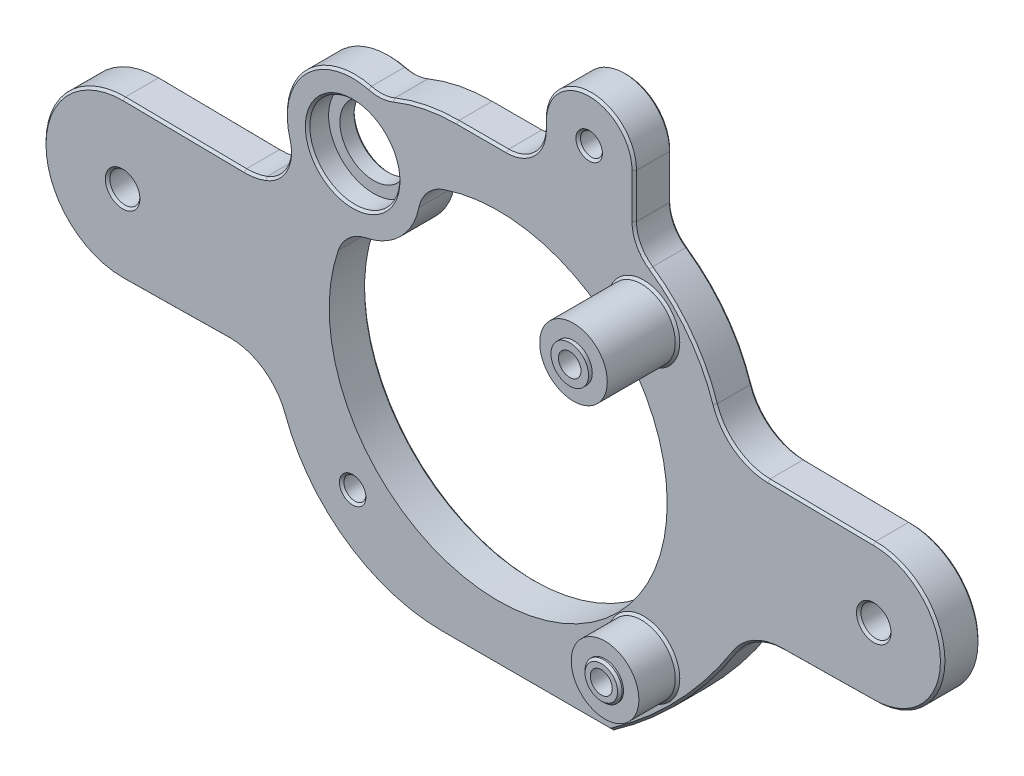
SolidWorks part; units mm, degrees
ref_plane "Plan de face" through (0, 0, 0) normal (0, 0, 1) x (1, 0, 0)
ref_plane "Plan de dessus" through (0, 0, 0) normal (0, 1, 0) x (1, 0, 0)
ref_plane "Plan de droite" through (0, 0, 0) normal (1, 0, 0) x (0, 0, -1)
sketch "Esquisse1" plane through (0, 0, 0) normal (0, 0, 1) x (1, 0, 0)
  line L0 (0, 0) -> (-38.75, 38.75) construction
  line L1 (0, 0) -> (35.404, 0) construction
  line L2 (24.2287, 72.0714) -> (24.2287, 52.2731) construction
  line L3 (-67.5838, 20.5722) -> (-99.8269, 20.9993)
  line L4 (-15, -60) -> (30.1201, -60)
  line L6 (2.2287, 60) -> (-11.0217, 60)
  line L7 (60, -60) -> (-60, 60) construction
  line L8 (60, 60) -> (-60, -60) construction
  line L9 (36.2287, 72.0714) -> (36.2287, 60.2744)
  line L10 (12.2287, 72.0714) -> (12.2287, 70)
  line L11 (100, 0) -> (-100, 0) construction
  line L12 (99.8094, -18.3536) -> (75.4463, -18.6759)
  line L13 (99.8786, 18.3542) -> (71.8047, 18.726)
  line L14 (0, 0) -> (0, -27.8905) construction
  line L15 (-71.5442, -20.6205) -> (-100.1731, -20.9993)
  line L16 (-60, 15) -> (-60, 0)
  line L17 (60, -30.1201) -> (60, -21)
  circle A0 centre (-38.75, 38.75) radius 2.925 construction
  circle A1 centre (38.75, 38.75) radius 2.925 construction
  circle A2 centre (38.75, -38.75) radius 2.925
  circle A3 centre (-38.75, -38.75) radius 2.925
  circle A4 centre (0, 0) radius 60 construction
  arc A5 (75.4463, -18.6759) -> (62.9711, -25.6508) centre (75.6447, -33.6746) ccw
  circle A6 centre (-38.75, -38.75) radius 1.5 construction
  arc A7 (57.7525, 29.0435) -> (40.5508, 52.0427) centre (15, 15) ccw
  arc A8 (-11.0217, 60) -> (-28.0842, 56.6398) centre (-11.0217, 15) ccw
  circle A9 centre (38.75, 38.75) radius 9 construction
  circle A10 centre (38.75, -38.75) radius 9 construction
  circle A11 centre (-38.75, -38.75) radius 9 construction
  circle A12 centre (-38.75, 38.75) radius 9
  arc A13 (-42.5804, 14.5572) -> (-14.5572, 42.5804) centre (0, 0) ccw
  arc A14 (30.1201, -60) -> (62.9711, -25.6508) centre (-38.75, 38.75) ccw
  circle A15 centre (38.75, 38.75) radius 2.925
  circle A16 centre (19.5, 56) radius 1.5 construction
  circle A17 centre (38.75, 38.75) radius 24.3481 construction
  circle A18 centre (-38.75, 38.75) radius 59.2505 construction
  circle A19 centre (24.2287, 72.0714) radius 12 construction
  circle A20 centre (24.2287, 72.0714) radius 2.925
  arc A21 (36.2287, 72.0714) -> (12.2287, 72.0714) centre (24.2287, 72.0714) ccw
  arc A22 (40.5508, 52.0427) -> (36.2287, 60.2744) centre (46.2287, 60.2744) cw
  arc A23 (12.2287, 70) -> (2.2287, 60) centre (2.2287, 70) cw
  arc A24 (99.8094, -18.3536) -> (99.8786, 18.3542) centre (100, 0) ccw
  arc A25 (-99.8269, 20.9993) -> (-100.1731, -20.9993) centre (-100, 0) ccw
  circle A26 centre (-100, 0) radius 4
  circle A27 centre (100, 0) radius 4
  arc A28 (-57.2593, -30.4644) -> (-15, -60) centre (-15, -15) ccw
  arc A29 (-71.5442, -20.6205) -> (-57.2593, -30.4644) centre (-71.3458, -35.6192) cw
  arc A30 (71.8047, 18.726) -> (57.7525, 29.0435) centre (72.0034, 33.7247) cw
  arc A31 (-62.1032, 21.5317) -> (-67.5838, 20.5722) centre (-67.3852, 35.5709) cw
  arc A32 (-34.3309, 56.1991) -> (-56.0265, 33.6979) centre (-38.75, 38.75) ccw
  arc A33 (-35.1295, 21.1179) -> (-21.1179, 35.1295) centre (-38.75, 38.75) ccw
  arc A34 (-14.5572, 42.5804) -> (-21.1179, 35.1295) centre (-11.3223, 33.1181) ccw
  arc A35 (-28.0842, 56.6398) -> (-34.3309, 56.1991) centre (-31.8759, 65.8931) cw
  arc A36 (-56.0265, 33.6979) -> (-62.1032, 21.5317) centre (-65.6245, 30.8912) cw
  arc A37 (-42.5804, 14.5572) -> (-35.1295, 21.1179) centre (-33.1181, 11.3223) cw
  point P14 (0, 0)
  point P23 (0, 0)
  point P39 (0, 0)
  point P46 (24.2287, 62.1723)
  point P57 (0, 0)
  point P75 (-59.6671, -20.4634)
  point P80 (-55.6948, 20.4148)
  point P92 (-39.9109, 20.7875)
  dimension "D1" = 45
  dimension "D2" = 4
  dimension "D4" = 5.85
  dimension "D7" = 18
  dimension "D3" = 120
  dimension "D5" = 77.5
  dimension "D6" = 15
  dimension "D8" = 4
  dimension "D9" = 90
  dimension "D10" = 5.85
  dimension "D11" = 45
  dimension "D12" = 3
  dimension "D13" = 3
  dimension "D14" = 4
  dimension "D15" = 19.5
  dimension "D16" = 24
  dimension "D17" = 5.85
  dimension "D18" = 10
  dimension "D20" = 21
  dimension "D21" = 8
  dimension "D22" = 36
  dimension "D23" = 10
  dimension "D24" = 10
  dimension "D19" = 200
extrude "Boss.-Extru.1" add sketch "Esquisse1" along normal blind 10
sketch "Esquisse3" plane through (0, 0, 10) normal (0, 0, 1) x (1, 0, 0)
  circle A0 centre (38.75, -38.75) radius 2.925
  circle A1 centre (38.75, -38.75) radius 9
  circle A2 centre (38.75, -38.75) radius 2.925 construction
  dimension "D1" = 18
extrude "Boss.-Extru.2" add sketch "Esquisse3" along normal blind 11.3
sketch "Esquisse7" plane through (0, 0, 21.3) normal (0, 0, 1) x (1, 0, 0)
  circle A0 centre (38.75, -38.75) radius 4.925
  circle A1 centre (38.75, -38.75) radius 9
  circle A2 centre (38.75, -38.75) radius 2.925 construction
  dimension "D1" = 2
extrude "Enlèv. mat.-Extru.3" cut sketch "Esquisse7" against normal blind 1
sketch "Esquisse4" plane through (0, 0, 10) normal (0, 0, 1) x (1, 0, 0)
  circle A0 centre (38.75, 38.75) radius 3
  circle A1 centre (38.75, 38.75) radius 9
  circle A2 centre (-100, 0) radius 4 construction
  circle A3 centre (-100, 0) radius 13.5 construction
  circle A4 centre (100, 0) radius 4 construction
  circle A5 centre (100, 0) radius 13.5 construction
  circle A6 centre (-100, 0) radius 4 construction
  dimension "D1" = 6
  dimension "D2" = 18
  dimension "D3" = 27
extrude "Boss.-Extru.3" add sketch "Esquisse4" along normal blind 19.7
sketch "Esquisse5" plane through (0, 0, 10) normal (0, 0, 1) x (1, 0, 0)
  circle A0 centre (-38.75, 38.75) radius 12
  dimension "D1" = 24
extrude "Enlèv. mat.-Extru.1" cut sketch "Esquisse5" against normal blind 5.6
sketch "Esquisse6" plane through (0, 0, 29.7) normal (0, 0, 1) x (1, 0, 0)
  circle A0 centre (38.75, 38.75) radius 5
  circle A1 centre (38.75, 38.75) radius 9
  circle A2 centre (38.75, 38.75) radius 3 construction
  dimension "D1" = 2
extrude "Enlèv. mat.-Extru.2" cut sketch "Esquisse6" against normal blind 1
chamfer "Chanfrein3" distance 0.6 angle 45 67 edges at (-29.75, 38.75, 0) (31.8198, -31.8198, 0) (-35.825, -38.75, 0) (41.675, -38.75, 0) (7.5601, -60, 0) (48.2575, -44.4626, 0) (51.0357, 41.9523, 0) (-4.3965, 60, 0) (-19.7168, 59.152, 0) (47.75, -38.75, 10) (-35.825, -38.75, 10) (47.75, 38.75, 10) (41.675, 38.75, 0) (27.1537, 72.0714, 0) (37.3749, 55.6257, 0) (36.2287, 66.1729, 0) (24.2287, 84.0714, 0) (12.2287, 71.0357, 0) (9.2998, 62.9289, 0) (27.1537, 72.0714, 10) (96, 0, 0) (-96, 0, 0) (68.3246, -20.582, 0) (87.6279, -18.5147, 0) (118.3545, -0.0346, 0) (85.8417, 18.5401, 0) (63.1259, 21.6338, 0) (-64.7986, 20.7956, 0) (-83.7054, 20.7858, 0) (-120.9993, 0.1731, 0) (-85.8586, -20.8099, 0) (-62.8343, -23.2679, 0) (-40.7789, -51.8843, 0) (7.5601, -60, 10) (-40.7789, -51.8843, 10) (-62.8343, -23.2679, 10) (-85.8586, -20.8099, 10) (-4.3965, 60, 10) (85.8417, 18.5401, 10) (63.1259, 21.6338, 10) (51.0357, 41.9523, 10) (37.3749, 55.6257, 10) (36.2287, 66.1729, 10) (24.2287, 84.0714, 10) (12.2287, 71.0357, 10) (9.2998, 62.9289, 10) (-19.7168, 59.152, 10) (-64.7986, 20.7956, 10) (-83.7054, 20.7858, 10) (-120.9993, 0.1731, 10) (118.3545, -0.0346, 10) (87.6279, -18.5147, 10) (68.3246, -20.582, 10) (48.2575, -44.4626, 10) (96, 0, 10) (-96, 0, 10) (-39.7266, 18.8274, 0) (-26.0221, 26.0221, 0) (-18.8274, 39.7266, 0) (-31.1722, 55.9179, 0) (-51.7078, 51.2438, 0) (-56.6783, 26.4228, 0) (-31.1722, 55.9179, 10) (-51.7078, 51.2438, 10) (-56.6783, 26.4228, 10) (-26.75, 38.75, 10) (43.675, -38.75, 21.3)
